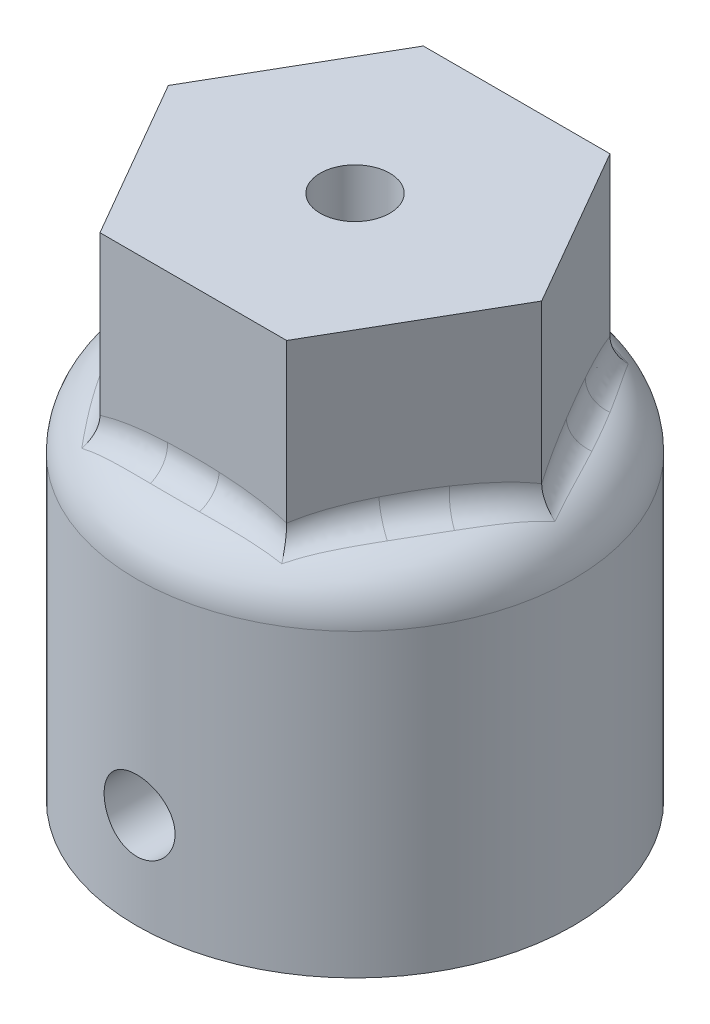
SolidWorks part; units mm, degrees
ref_plane "Front Plane" through (0, 0, 0) normal (0, 0, 1) x (1, 0, 0)
ref_plane "Top Plane" through (0, 0, 0) normal (0, 1, 0) x (1, 0, 0)
ref_plane "Right Plane" through (0, 0, 0) normal (1, 0, 0) x (0, 0, -1)
sketch "Sketch1" plane through (0, 0, 0) normal (0, 1, 0) x (1, 0, 0)
  line L1 (-3.4208, 5.925) -> (-6.8416, 0)
  line L2 (-6.8416, 0) -> (-3.4208, -5.925)
  line L3 (-3.4208, -5.925) -> (3.4208, -5.925)
  line L4 (3.4208, -5.925) -> (6.8416, 0)
  line L5 (6.8416, 0) -> (3.4208, 5.925)
  line L6 (3.4208, 5.925) -> (-3.4208, 5.925)
  circle A0 centre (0, 0) radius 5.925 construction
  circle A1 centre (0, 0) radius 1.275
  dimension "D2" = 2.55
  dimension "D1" = 11.85
extrude "Boss-Extrude1" add sketch "Sketch1" along normal blind 6.25
sketch "Sketch2" plane through (0, 0, 0) normal (0, -1, 0) x (1, 0, 0)
  circle A0 centre (0, 0) radius 8
  circle A1 centre (0, 0) radius 3.025
  dimension "D1" = 16
  dimension "D2" = 6.05
extrude "Boss-Extrude2" add sketch "Sketch2" along normal blind 13
sketch "Sketch3" plane through (0, 0, 0) normal (0, 0, 1) x (1, 0, 0)
  line L0 (0, -13) -> (0, -9.5) construction
  line L1 (-8, -13) -> (8, -13) construction
  circle A0 centre (0, -9.5) radius 1.3
  point P6 (0, -9.2973)
  dimension "D1" = 2.6
  dimension "D2" = 3.5
extrude "Cut-Extrude1" cut sketch "Sketch3" against normal through all both and the other way through all
fillet "Fillet1" radius 2 1 edges at (0, 0, -8)
fillet "Fillet2" radius 1 18 edges at (5.1312, 0, -2.9625) (0, 0, -5.925) (-5.1312, 0, -2.9625) (-5.1312, 0, 2.9625) (0, 0, 5.925) (5.1312, 0, 2.9625)
